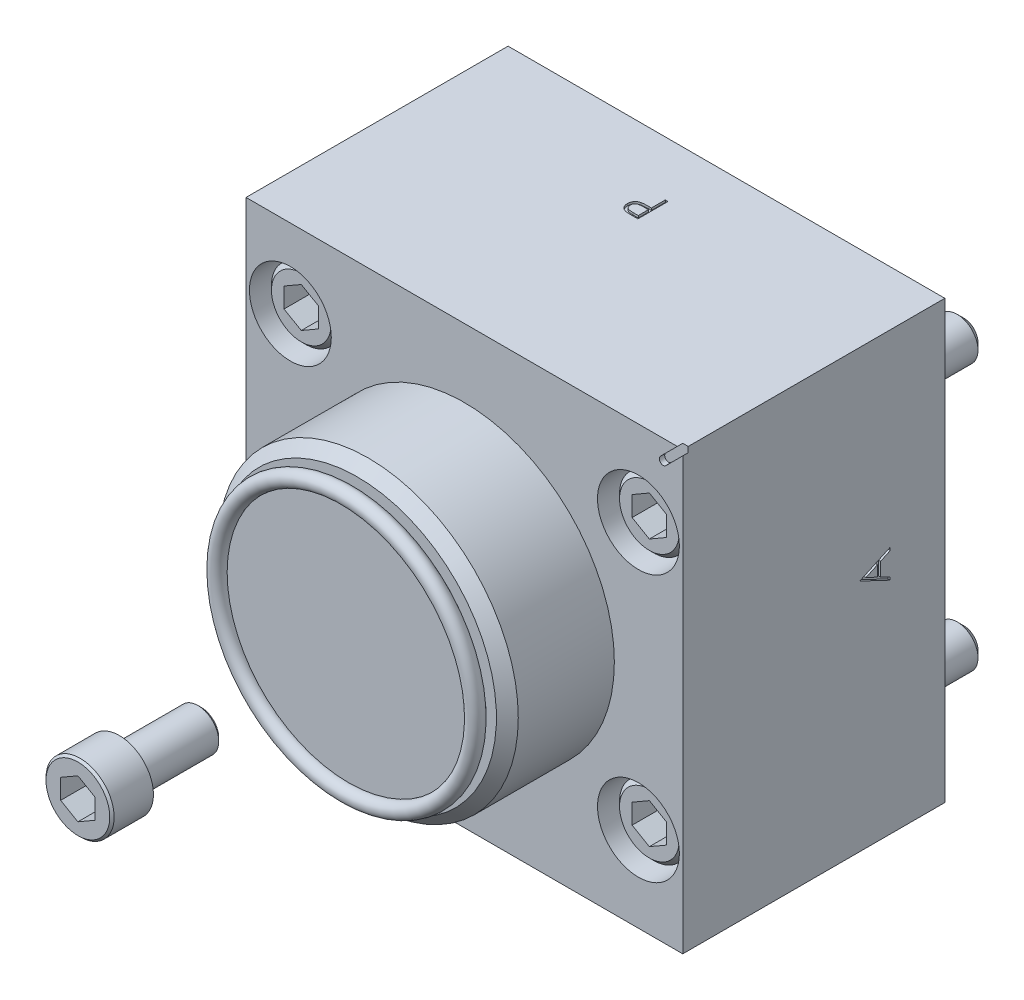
SolidWorks part; units mm, degrees
ref_plane "Front Plane" through (0, 0, 0) normal (0, 0, 1) x (1, 0, 0)
ref_plane "Top Plane" through (0, 0, 0) normal (0, 1, 0) x (1, 0, 0)
ref_plane "Right Plane" through (0, 0, 0) normal (1, 0, 0) x (0, 0, -1)
imported_body "Imported1"
imported_body "Imported2"
sketch "Sketch1" plane through (0, 0, 0) normal (1, 0, 0) x (0, 0, -1)
  line L0 (0, 0) -> (-30.48, 0) construction
  line L1 (0, 0) -> (0, 50.8) construction
  text T0 "<r90>A</r>"
  dimension "D1" = 25.4
  dimension "D2" = 6.35
extrude "Cut-Extrude1" cut sketch "Sketch1" against normal blind 0.254
sketch "Sketch2" plane through (0, 50.8, 0) normal (0, 1, 0) x (1, 0, 0)
  line L0 (0, -29.845) -> (0, 0) construction
  line L1 (0, 0) -> (-50.8, 0) construction
  text T0 "<r180>P</r>"
  dimension "D1" = 25.4
  dimension "D2" = 6.35
extrude "Cut-Extrude2" cut sketch "Sketch2" against normal blind 0.254
sketch "Sketch3" plane through (-50.8, 0, 0) normal (-1, 0, 0) x (0, 0, 1)
  line L0 (30.48, 50.8) -> (0, 50.8) construction
  line L1 (0, 50.8) -> (0, 0) construction
  text T0 "<r-90>B</r>"
  dimension "D1" = 25.4
  dimension "D2" = 6.35
extrude "Cut-Extrude3" cut sketch "Sketch3" against normal blind 0.254
sketch "Sketch4" plane through (0, 0, 0) normal (0, -1, 0) x (1, 0, 0)
  line L0 (-50.8, 30.48) -> (-50.8, 0) construction
  line L1 (-50.8, 0) -> (0, 0) construction
  text T0 "T"
  dimension "D1" = 25.4
  dimension "D2" = 6.35
extrude "Cut-Extrude4" cut sketch "Sketch4" against normal blind 0.254
